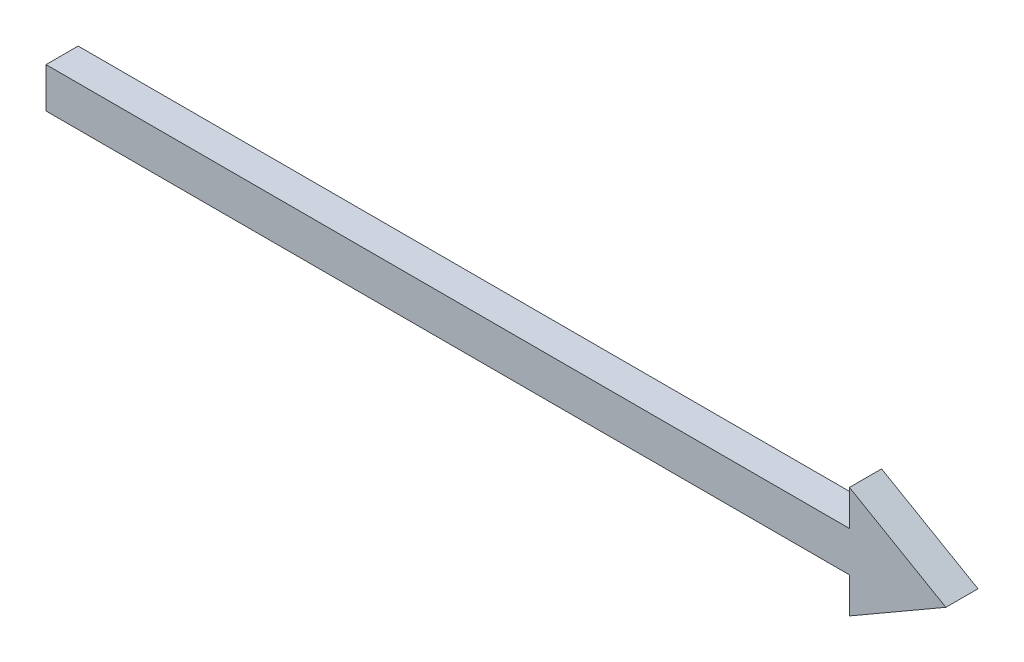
SolidWorks part; units mm, degrees
ref_plane "Face" through (0, 0, 0) normal (0, 0, 1) x (1, 0, 0)
ref_plane "Dessus" through (0, 0, 0) normal (0, 1, 0) x (1, 0, 0)
ref_plane "Droite" through (0, 0, 0) normal (1, 0, 0) x (0, 0, -1)
sketch "Esquisse1" plane through (0, 0, 0) normal (0, 0, 1) x (1, 0, 0)
  line L0 (0, 0) -> (192, 0) construction
  line L1 (180, 2.5) -> (180, 6.9282)
  line L2 (80, 2.5) -> (180, 2.5)
  line L3 (80, 2.5) -> (80, -2.5)
  line L4 (80, -2.5) -> (180, -2.5)
  line L5 (180, 6.9282) -> (192, 0)
  line L6 (192, 0) -> (180, -6.9282)
  line L7 (180, -6.9282) -> (180, -2.5)
  dimension "D1" = 5
  dimension "D2" = 100
  dimension "D3" = 80
  dimension "D4" = 12
  dimension "D5" = 60
  dimension "D6" = 60
extrude "Boss.-Extru.1" add sketch "Esquisse1" along normal mid plane 4
